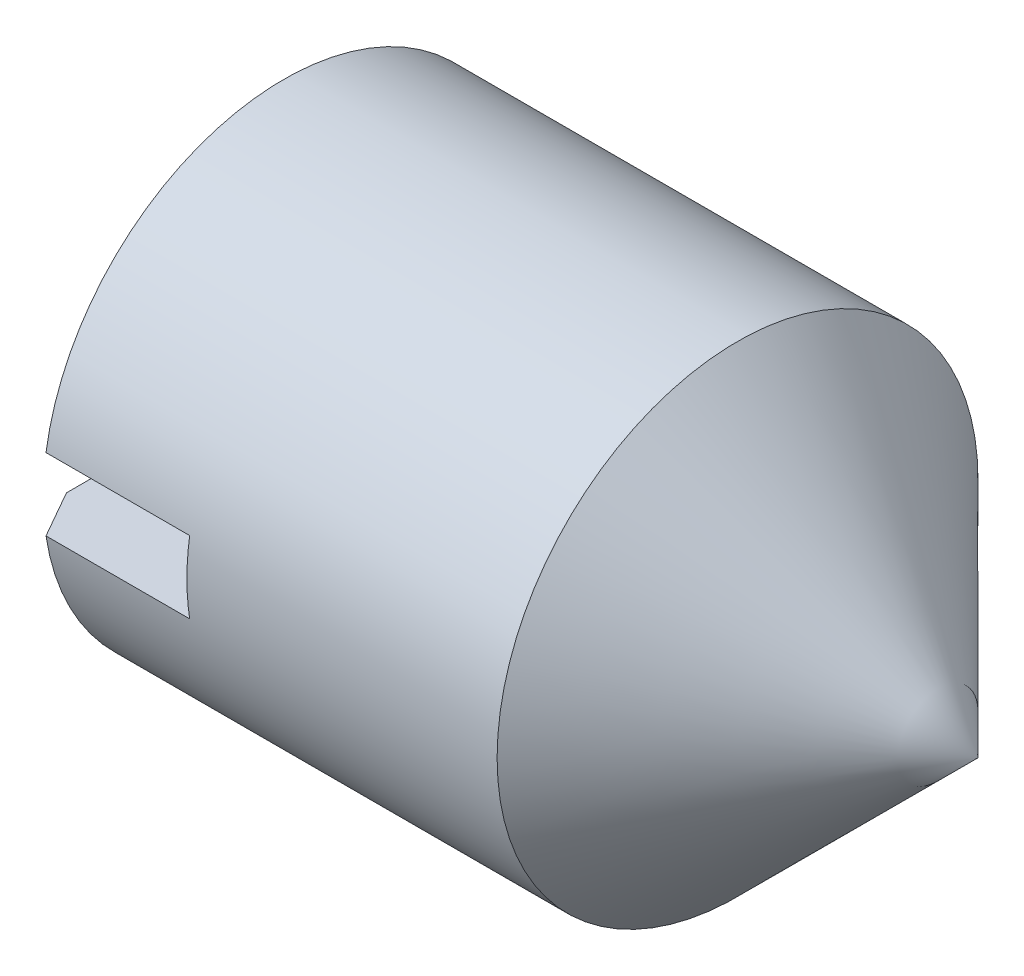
SolidWorks part; units mm, degrees
ref_plane "Plane1" through (0, 0, 0) normal (0, 0, 1) x (1, 0, 0)
ref_plane "Plane2" through (0, 0, 0) normal (0, 1, 0) x (1, 0, 0)
ref_plane "Plane3" through (0, 0, 0) normal (1, 0, 0) x (0, 0, -1)
sketch "BodySke" plane through (0, 0, 0) normal (0, 0, 1) x (1, 0, 0)
  line L0 (0, 0) -> (0, 1.61)
  line L1 (0, 1.61) -> (0.2252, 2)
  line L2 (0.2252, 2) -> (4, 2)
  line L3 (4, 2) -> (6, 0)
  line L4 (6, 0) -> (0, 0)
  line L5 (-12.7, 0) -> (88.9, 0) construction
  line L6 (4, -2) -> (6, 0) construction
  line L7 (0.35, 15.875) -> (0.35, -3.175) construction
  line L8 (0, -1.61) -> (0.2252, -2) construction
  dimension "Cone_ang" = 90
  dimension "Length" = 6
  dimension "Diameter" = 4
  dimension "Drive_ch_ang" = 60
  dimension "Minor_dia" = 3.22
  dimension "Advance" = 0.7
revolve "BaseBody" add sketch "BodySke"
extrude "Slot" cut sketch "Sketch2" against normal blind 1.42
sketch "Sketch2" plane through (0, 0, 0) normal (-1, 0, 0) x (0, 0, 1)
  line L0 (2, 0.3) -> (-2, 0.3)
  line L1 (2, -0.3) -> (2, 0.3)
  line L2 (-2, -0.3) -> (-2, 0.3)
  line L4 (2, -0.3) -> (-2, -0.3)
  circle A2 centre (0, 0) radius 2 construction
  dimension "D1" = 0.3
  dimension "Slot_width" = 0.6
sketch "ThdSchSke" plane through (0, 0, 0) normal (0, 0, 1) x (1, 0, 0)
  line L0 (0.2252, -1.61) -> (-0.0479, -2)
  line L1 (0.2252, -1.61) -> (0.4982, -2)
  line L2 (0.4982, -2) -> (0.4982, -2.5)
  line L3 (-3.175, 0) -> (5.1513, 0) construction
  line L4 (0.2252, 2) -> (0.2252, -2) construction
  line L5 (0.4982, -2.5) -> (-0.0479, -2.5)
  line L6 (-0.0479, -2.5) -> (-0.0479, -2)
  dimension "Thread_minor" = 3.22
  dimension "Diameter" = 4
  dimension "SideAngle" = 55
  dimension "VeeAngle" = 70
  dimension "Overcut" = 5
revolve "ThreadSchematic" [suppressed] cut sketch "ThdSchSke" angle 360 about L3
pattern_linear "ThdSchPat" [suppressed]
equation "\"Thread_minor@ThreadCosmetic\" = \"Minor_dia@BodySke\""
equation "\"Thread_minor@ThdSchSke\" = \"Thread_minor@ThreadCosmetic\""
equation "\"Diameter@ThdSchSke\" = \"Diameter@BodySke\""
equation "\"Overcut@ThdSchSke\" = \"Diameter@BodySke\" * 1.25"
equation "\"Num_threads@ThdSchPat\" = int( (\"Length@BodySke\" - ( ( ( \"Diameter@BodySke\" - \"Minor_dia@BodySke\" ) * 0.5 ) / tan( \"Drive_ch_ang@BodySke\" * 0.017453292 ) ) - ( ( \"Diameter@BodySke\" * 0.5 ) / tan( \"Con"
equation "\"Advance@ThdSchPat\" = (\"Length@BodySke\" - ( ( ( \"Diameter@BodySke\" - \"Minor_dia@BodySke\" ) * 0.5 ) / tan( \"Drive_ch_ang@BodySke\" * 0.017453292 ) ) - ( ( \"Diameter@BodySke\" * 0.5 ) / tan( \"Cone_ang@Bod"
equation "' \"Num_threads@ThdSchPat\" = \"Num_threads@ThdSchPat\" - sgn( \"Num_threads@ThdSchPat\" - 1) '---chamfered tips only---"
equation "\"D1@Sketch2\" = \"Slot_width@Sketch2\" / 2"
